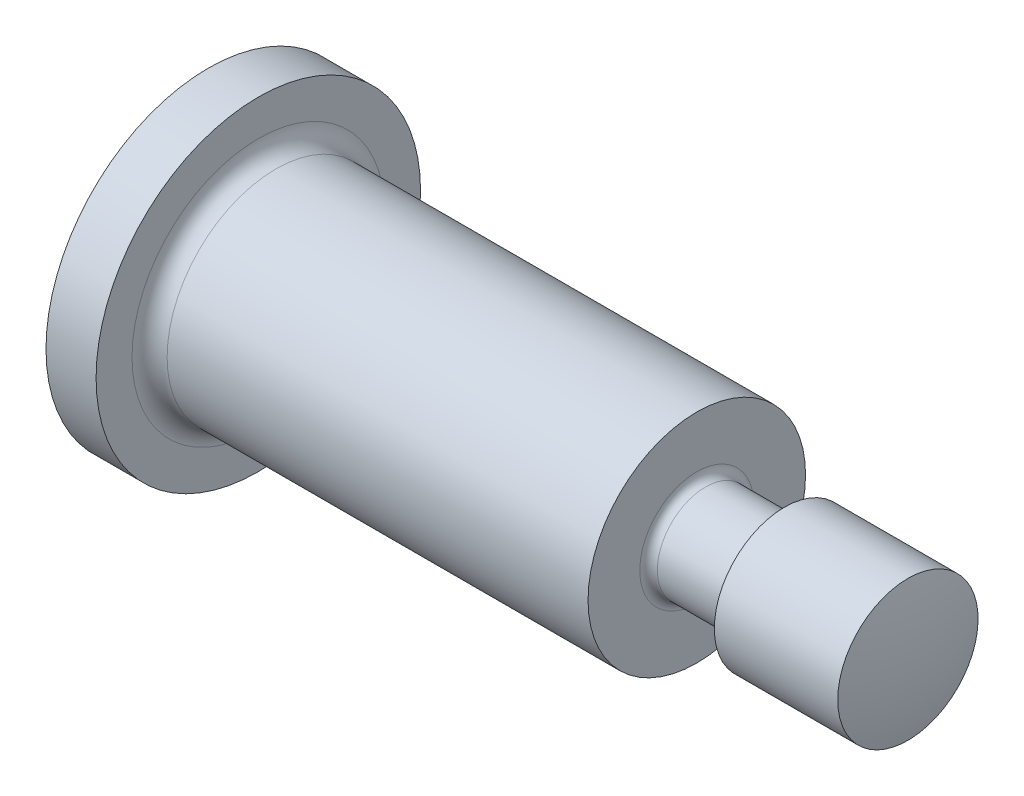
SolidWorks part; units mm, degrees
ref_plane "Front" through (0, 0, 0) normal (0, 0, 1) x (1, 0, 0)
ref_plane "Top" through (0, 0, 0) normal (0, 1, 0) x (1, 0, 0)
ref_plane "Right" through (0, 0, 0) normal (1, 0, 0) x (0, 0, -1)
sketch "Sketch1" plane through (0, 0, 0) normal (1, 0, 0) x (0, 0, -1)
  circle A0 centre (0, 0) radius 1.85
extrude "BaseHead" add sketch "Sketch1" along normal blind 1.1
sketch "Sketch2" plane through (1.1, -0.6091, 0.4548) normal (1, 0, 0) x (0, 0, -1)
  circle A0 centre (0.4548, 0.6091) radius 1.24
  circle A1 centre (0.4548, 0.6091) radius 1.85 construction
  dimension "d1" = 2.48
extrude "BaseBody" add sketch "Sketch2" along normal blind 5
sketch "Sketch3" plane through (6.1, 0.5391, 0.1937) normal (1, 0, 0) x (0, 0, -1)
  circle A0 centre (0.1937, -0.5391) radius 0.8
  circle A2 centre (0.1937, -0.5391) radius 1.24 construction
  dimension "d" = 1.6
extrude "BaseEnd" add sketch "Sketch3" along normal blind 2.5
sketch "Sketch4" plane through (-6.1, 0.55, 0) normal (0, 0, 1) x (0, -1, 0)
  line L0 (0.55, 8.528) -> (0.55, -1.878) construction
  line L1 (-5, 13.2) -> (0, 13.2)
  line L2 (-5, 13.2) -> (-5, 12.2)
  line L3 (-5, 12.2) -> (0, 12.2)
  line L4 (0, 13.2) -> (0, 12.2)
  line L7 (1.79, 12.2) -> (-0.69, 12.2) construction
  dimension "a" = 1
  dimension "d2" = 1.1
  dimension "D3" = 5
revolve "Cut-Revolve2" cut sketch "Sketch4" angle 360 about L0
fillet "Fillet1" radius 0.1 2 edges at (6.1, 0.55, 0) (7.1, 0.55, 0)
sketch "Sketch5" plane through (-0.85, -0.85, 0) normal (0, 0, 1) x (0, 1, 0)
  line L1 (0.6, -0.85) -> (1.1, -0.85)
  line L2 (0.6, -0.85) -> (0.6, -1.35)
  line L3 (0.6, -1.35) -> (1.1, -1.35)
  line L4 (1.1, -0.85) -> (1.1, -1.35)
  dimension "n" = 0.5
  dimension "m" = 0.25
  dimension "t" = 0.5
extrude "Slot" cut sketch "Sketch5" against normal through all and the other way through all
sketch "Sketch6" plane through (-7.5888, 2.0888, 0) normal (0, 0, 1) x (0, -1, 0)
  line L0 (2.0888, 13.2489) -> (2.0888, -3.5713) construction
  line L1 (0.2388, 8.6888) -> (0.2388, 7.5888) construction
  line L3 (2.8888, 16.1888) -> (1.2888, 16.1888) construction
  line L4 (-1.4112, 12.6888) -> (-3.4112, 12.6888)
  line L5 (2.0888, 16.1888) -> (2.0888, 18.1888)
  line L6 (2.0888, 18.1888) -> (-3.4112, 18.1888)
  line L8 (0.2388, 5.5888) -> (2.0888, 5.5888)
  line L9 (2.0888, 5.5888) -> (2.0888, 7.5888)
  line L10 (0.2388, 8.1177) -> (0.2388, 5.5888)
  line L12 (-3.4112, 12.6888) -> (-3.4112, 18.1888)
  arc A0 (0.2388, 8.1177) -> (2.0888, 7.5888) centre (2.0888, 11.0888) ccw
  arc A1 (2.0888, 16.1888) -> (-1.4112, 12.6888) centre (2.0888, 12.6888) ccw
  dimension "D1" = 2
  dimension "r" = 3.5
  dimension "D2" = 2
  dimension "D3" = 2
revolve "BaseTop" cut sketch "Sketch6" angle 360 about L0
fillet "HeadFillet" radius 0.2 1 edges at (1.1, 0, -1.24)
sketch "Sketch7" plane through (0, 0, 0) normal (0, 0, 1) x (1, 0, 0)
  line L0 (8.5073, 0.4969) -> (8.6823, 0.8)
  line L1 (8.6823, 0.8) -> (8.6823, 1.15)
  line L2 (8.6823, 1.15) -> (8.3323, 1.15)
  line L3 (8.3323, 1.15) -> (8.3323, 0.8)
  line L4 (8.3323, 0.8) -> (8.5073, 0.4969)
  line L5 (8.5073, 0.8) -> (8.5073, -0.8) construction
  line L7 (0, 0) -> (9.5069, 0) construction
  dimension "D1" = 0.35
  dimension "D2" = 1.6
revolve "Cut-Revolve10" [suppressed] cut sketch "Sketch7" angle 360 about L7
pattern_linear "LPattern10" [suppressed] count 4 spacing 0.42 along (1, 0, 0)
equation "\"m@Sketch5\" = \"n@Sketch5\" / 2"
equation "\"D2@Sketch7\" =\"d@Sketch3\""
equation "\"D1@Sketch7\" = ( \"b@BaseEnd\" -\"THD_MINOR@ThreadCosmetic1\")  / 2"
equation "\"D3@LPattern10\" = \"D1@Sketch7\" * 1.2"
equation "\"D1@LPattern10\" = ( \"b@BaseEnd\"  - \"a@Sketch4\" ) / \"D3@LPattern10\" "
